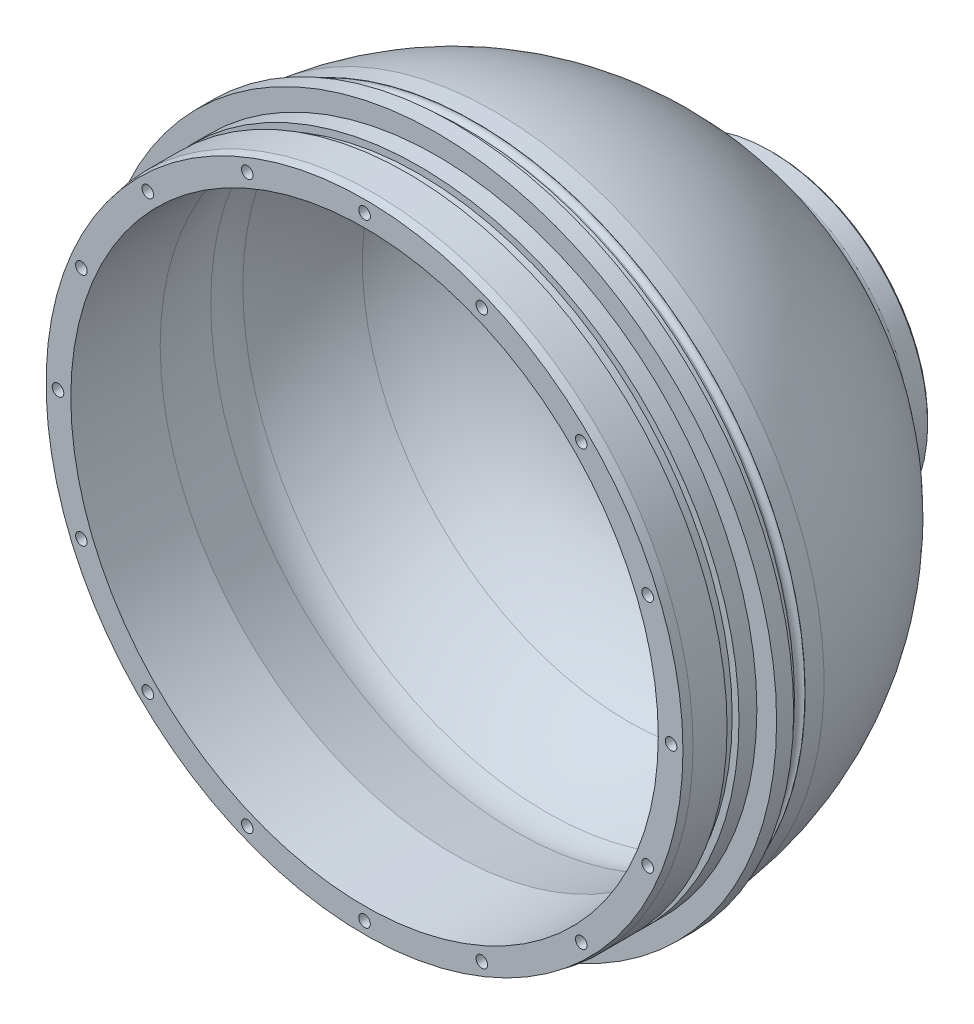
SolidWorks part; units mm, degrees
ref_plane "Front Plane" through (0, 0, 0) normal (0, 0, 1) x (1, 0, 0)
ref_plane "Top Plane" through (0, 0, 0) normal (0, 1, 0) x (1, 0, 0)
ref_plane "Right Plane" through (0, 0, 0) normal (1, 0, 0) x (0, 0, -1)
sketch "Sketch1" plane through (0, 0, 0) normal (1, 0, 0) x (0, 0, -1)
  line L0 (0, 0) -> (0, -87.63) construction
  line L1 (0, -87.63) -> (0, -101.346)
  line L2 (0, -87.63) -> (26.67, -87.63)
  line L3 (0, 0) -> (164.6305, 0) construction
  line L4 (0, -101.346) -> (26.67, -101.346)
  line L5 (26.67, -101.346) -> (26.67, -98.298)
  line L6 (26.67, -98.298) -> (38.7801, -98.298)
  line L8 (121.7669, 0) -> (121.7669, -46.99)
  line L9 (121.7669, 0) -> (101.4469, 0)
  line L10 (26.67, -87.63) -> (49.53, -91.9045)
  line L11 (101.4469, 0) -> (101.4469, -57.9788)
  line L12 (121.7669, -46.99) -> (113.7225, -46.99)
  arc A1 (49.53, -91.9045) -> (101.4469, -57.9788) centre (26.5169, 0) ccw
  arc A2 (38.7801, -98.298) -> (113.7225, -46.99) centre (26.5169, 0) ccw
  dimension "D6" = 99.06
  dimension "D7" = 94.742
  dimension "D1" = 87.63
  dimension "D2" = 101.346
  dimension "D3" = 26.67
  dimension "D4" = 26.67
  dimension "D5" = 3.048
  dimension "D8" = 46.99
  dimension "D9" = 20.32
  dimension "D10" = 22.86
  dimension "D11" = 12.1101
  dimension "D12" = 95.0969
revolve "hemi" add sketch "Sketch1" angle 360 about L3
sketch "Sketch2" plane through (0, 0, 0) normal (0, 0, 1) x (1, 0, 0)
  circle A0 centre (0, 0) radius 95.4532
  dimension "D1" = 190.9064
extrude "oring_plug" cut sketch "Sketch2" against normal blind 21.59 flip side to cut
ref_plane "oring_plane" through (0, 0, -12.7) normal (0, 0, 1) x (1, 0, 0)
sketch "Sketch3" plane through (0, 0, -12.7) normal (0, 0, 1) x (1, 0, 0)
  circle A0 centre (0, 0) radius 93.4212
  dimension "D1" = 186.8424
extrude "oring_groove" cut sketch "Sketch3" against normal blind 3.556 flip side to cut
chamfer "lead_in_chamfer" distance 2.54 distance2 0.4572 1 edges at (95.4532, 0, 0)
fillet "inside_blkhd_fillet" radius 50.8 1 edges at (57.9788, 0, -101.4469)
fillet "inside_flange_fillet" radius 19.05 1 edges at (91.9045, 0, -49.53)
ref_plane "ortman_plane" through (0, 0, -29.972) normal (0, 0, -1) x (-1, 0, 0)
sketch "Sketch4" plane through (0, 0, -29.972) normal (0, 0, -1) x (-1, 0, 0)
  circle A0 centre (0, 0) radius 96.647
  dimension "D1" = 193.294
extrude "ortman_groove" cut sketch "Sketch4" along normal blind 3.175 flip side to cut
fillet "ortman_fillet" radius 1.5875 2 edges at (-96.647, 0, -29.972) (-96.647, 0, -33.147)
sketch "Sketch5" plane through (0, 0, 0) normal (0, 0, 1) x (1, 0, 0)
  circle A0 centre (0, 0) radius 91.44 construction
  circle A1 centre (0, 91.44) radius 1.7272
  circle A2 centre (34.9926, 84.4795) radius 1.7272
  circle A3 centre (64.6578, 64.6578) radius 1.7272
  circle A4 centre (84.4795, 34.9926) radius 1.7272
  circle A5 centre (91.44, 0) radius 1.7272
  circle A6 centre (84.4795, -34.9926) radius 1.7272
  circle A7 centre (64.6578, -64.6578) radius 1.7272
  circle A8 centre (34.9926, -84.4795) radius 1.7272
  circle A9 centre (0, -91.44) radius 1.7272
  circle A10 centre (-34.9926, -84.4795) radius 1.7272
  circle A11 centre (-64.6578, -64.6578) radius 1.7272
  circle A12 centre (-84.4795, -34.9926) radius 1.7272
  circle A13 centre (-91.44, 0) radius 1.7272
  circle A14 centre (-84.4795, 34.9926) radius 1.7272
  circle A15 centre (-64.6578, 64.6578) radius 1.7272
  circle A16 centre (-34.9926, 84.4795) radius 1.7272
  dimension "D1" = 182.88
  dimension "D2" = 3.4544
extrude "male_bolt_circle_holes" cut sketch "Sketch5" against normal blind 7.62
sketch "blkhd_holes" plane through (0, 0, -121.7669) normal (0, 0, -1) x (-1, 0, 0)
  line L0 (0, 0) -> (0, 29.2621) construction
  line L1 (0, 0) -> (29.21, 0) construction
  circle A0 centre (0, 0) radius 4.953
  circle A1 centre (0, 0) radius 10.16 construction
  circle A2 centre (29.21, 16.002) radius 2.7051
  circle A3 centre (29.21, 16.002) radius 7.9375 construction
  circle A4 centre (-29.21, 16.002) radius 7.9375 construction
  circle A5 centre (-29.21, 16.002) radius 2.7051
  circle A6 centre (29.21, -16.002) radius 2.7051
  circle A7 centre (29.21, -16.002) radius 7.9375 construction
  circle A8 centre (-22.86, -5.08) radius 3.4544
  circle A9 centre (-22.86, -5.08) radius 9.525 construction
  circle A10 centre (8.89, -27.94) radius 5.7531
  circle A11 centre (8.89, -27.94) radius 13.335 construction
  circle A12 centre (12.7, 27.94) radius 11.43 construction
  circle A13 centre (12.7, 27.94) radius 5.7531
  circle A15 centre (-18.1738, -27.8569) radius 6.5481
  circle A16 centre (-18.1738, -27.8569) radius 13.729 construction
  circle A17 centre (0, 0) radius 46.99 construction
  dimension "D1" = 9.906
  dimension "D2" = 20.32
  dimension "D3" = 5.4102
  dimension "D6" = 15.875
  dimension "D7" = 6.9088
  dimension "D10" = 19.05
  dimension "D11" = 11.5062
  dimension "D12" = 26.67
  dimension "D15" = 11.5062
  dimension "D17" = 12.7
  dimension "D18" = 22.86
  dimension "D19" = 13.0962
  dimension "D4" = 16.002
  dimension "D5" = 29.21
  dimension "D8" = 5.08
  dimension "D9" = 22.86
  dimension "D13" = 27.94
  dimension "D14" = 8.89
  dimension "D16" = 27.94
fillet "aft_land_fillet" radius 3.175 1 edges at (46.99, 0, -113.7225)
chamfer "Chamfer2" distance 0.762 angle 45 1 edges at (46.99, 0, -121.7669)
extrude "blkhd_thru_holes" cut sketch "blkhd_holes" against normal through all
sketch "Sketch7" plane through (0, 0, -121.7669) normal (0, 0, -1) x (-1, 0, 0)
  circle A0 centre (-10.16, 22) radius 6.35
  dimension "D1" = 12.7
  dimension "D2" = 10.16
  dimension "D3" = 22
sketch "Sketch8" plane through (0, 0, -121.7669) normal (0, 0, -1) x (-1, 0, 0)
  circle A0 centre (12.7, 27.94) radius 11.43
  circle A1 centre (29.21, 16.002) radius 7.9375
  circle A2 centre (29.21, -16.002) radius 7.9375
  circle A3 centre (8.89, -27.94) radius 13.335
  circle A4 centre (-22.86, -5.08) radius 9.525
  circle A5 centre (-29.21, 16.002) radius 7.9375
  circle A6 centre (0, 0) radius 10.16
  circle A7 centre (-18.1738, -27.8569) radius 12.319
  dimension "D1" = 22.86
  dimension "D2" = 15.875
  dimension "D3" = 19.05
  dimension "D4" = 26.67
  dimension "D5" = 15.875
  dimension "D6" = 15.875
  dimension "D7" = 20.32
  dimension "D8" = 24.638
extrude "lands" cut sketch "Sketch8" against normal blind 0.0762
extrude "press_relief_hole" cut sketch "Sketch7" against normal through all
sketch "Sketch9" plane through (0, 0, -121.7669) normal (0, 0, -1) x (-1, 0, 0)
  circle A0 centre (-10.16, 22) radius 9.5504
  dimension "D1" = 19.1008
extrude "press_relief_cbore" cut sketch "Sketch9" against normal blind 5.08
sketch "Sketch10" plane through (0, 0, -101.4469) normal (0, 0, 1) x (1, 0, 0)
  circle A0 centre (0, 0) radius 9.525
  circle A1 centre (22.86, -5.08) radius 9.525
  dimension "D1" = 19.05
  dimension "D2" = 19.05
extrude "Cut-Extrude1" cut sketch "Sketch10" against normal blind 0.254
chamfer "pr_relief_chamfer" distance 0.762 angle 30 1 edges at (0.6096, 22, -121.7669)
chamfer "Chamfer3" distance 0.508 angle 30 1 edges at (16.51, 22, -101.4469)
sketch "Sketch12" plane through (0, 0, 0) normal (0, 0, 1) x (1, 0, 0)
  line L0 (-91.44, 0) -> (91.44, 0) construction
